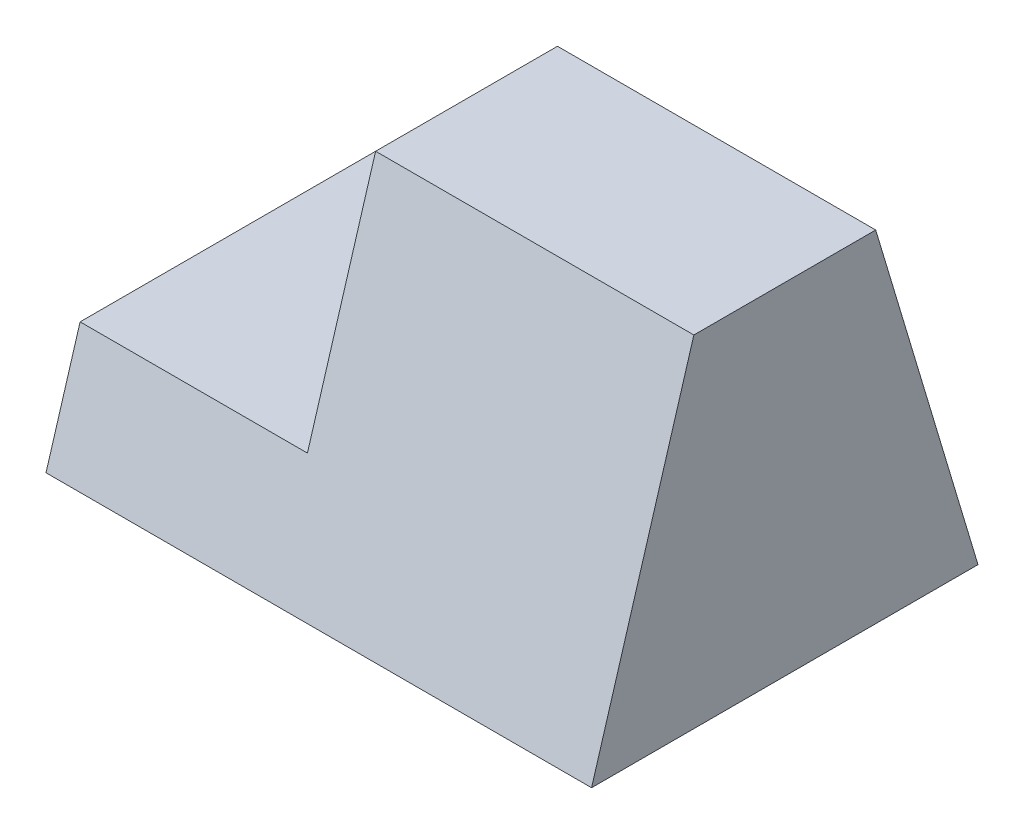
SolidWorks part; units mm, degrees
ref_plane "前视基准面" through (0, 0, 0) normal (0, 0, 1) x (1, 0, 0)
ref_plane "上视基准面" through (0, 0, 0) normal (0, 1, 0) x (1, 0, 0)
ref_plane "右视基准面" through (0, 0, 0) normal (1, 0, 0) x (0, 0, -1)
sketch "草图1" plane through (0, 0, 0) normal (1, 0, 0) x (0, 0, -1)
  line L0 (-42.5, 0) -> (42.5, 0)
  line L1 (42.5, 0) -> (20, 75)
  line L2 (20, 75) -> (-20, 75)
  line L3 (-20, 75) -> (-42.5, 0)
  line L4 (0, -59.4126) -> (0, 96.3448) construction
  dimension "D1" = 75
  dimension "D2" = 40
  dimension "D3" = 85
extrude "拉伸1" add sketch "草图1" along normal blind 120
sketch "草图2" plane through (0, 0, 0) normal (-1, 0, 0) x (0, 0, 1)
  line L0 (-35, 25) -> (35, 25)
  line L4 (42.5, 0) -> (20, 75)
  line L5 (20, 75) -> (-20, 75)
  line L6 (-20, 75) -> (-42.5, 0)
  line L7 (-42.5, 0) -> (42.5, 0)
  line L8 (35, 25) -> (20, 75)
  line L9 (20, 75) -> (-20, 75)
  line L10 (-20, 75) -> (-35, 25)
  dimension "D2" = 50
  dimension "D1" = 0
extrude "切除-拉伸1" cut sketch "草图2" against normal blind 50
